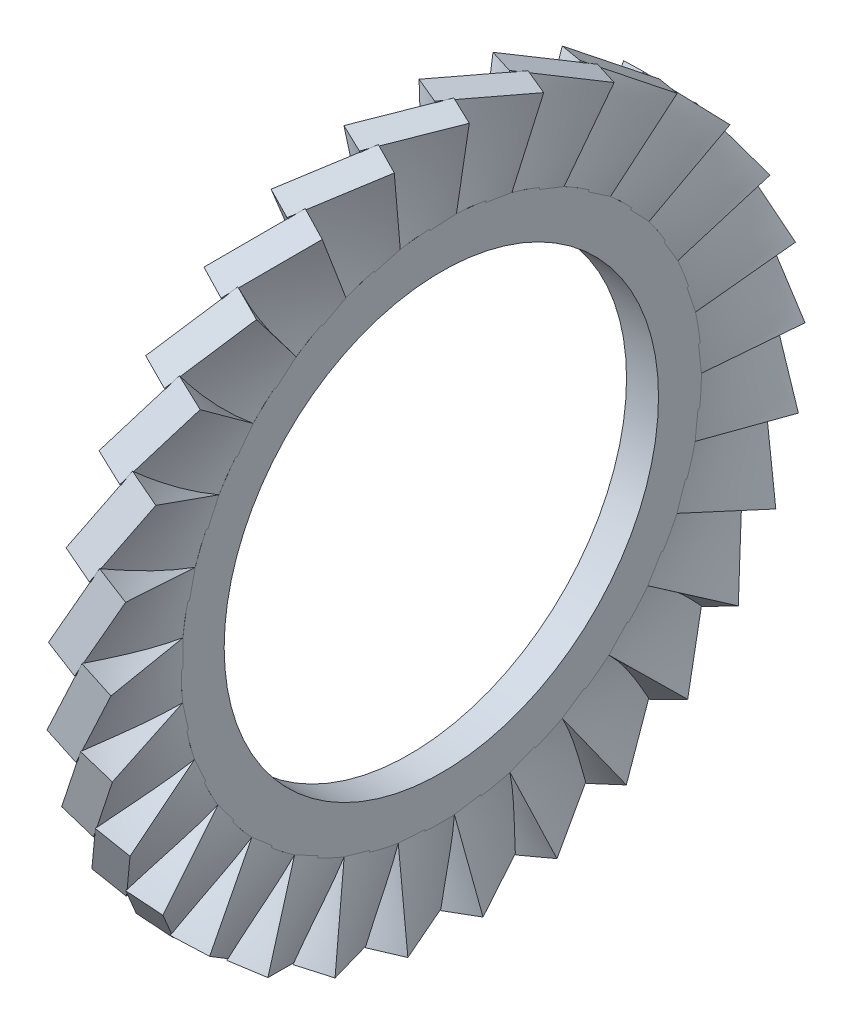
SolidWorks part; units mm, degrees
ref_plane "Plan1" through (0, 0, 0) normal (0, 0, 1) x (1, 0, 0)
ref_plane "Plan2" through (0, 0, 0) normal (0, 1, 0) x (1, 0, 0)
ref_plane "Plan3" through (0, 0, 0) normal (1, 0, 0) x (0, 0, -1)
sketch "Esquisse1" plane through (0, 0, 0) normal (0, 0, 1) x (1, 0, 0)
  line L0 (-4, 0) -> (4, 0) construction
  line L1 (0.6, 8.15) -> (-0.6, 8.15)
  line L2 (-0.6, 8.15) -> (-0.6, 9.76)
  line L3 (-0.6, 9.76) -> (0.6, 9.76)
  line L4 (0, 0) -> (0, 8) construction
  line L5 (0.6, 8.15) -> (0.6, 9.76)
  point P10 (0, 9.76)
  point P11 (0, 8.15)
  dimension "D1" = 8.15
  dimension "D2" = 9.76
  dimension "D3" = 0.6
revolve "Ame rondelle" add sketch "Esquisse1" angle 360 about L0
ref_plane "Plan4" through (0, 0, 9.6986) normal (0, 0, 1) x (1, 0, 0)
ref_plane "Plan5" through (0, 0, 13) normal (0, 0, 1) x (1, 0, 0)
sketch "Esquisse2" plane through (0, 0, 9.6986) normal (0, 0, 1) x (1, 0, 0)
  line L0 (0.6, 1.0928) -> (0.6, -1.0928)
  line L1 (-0.6, 1.0928) -> (0.6, 1.0928)
  line L3 (-0.6, 9.76) -> (-0.6, -9.76) construction
  line L4 (-0.6, 1.0928) -> (-0.6, -1.0928)
  line L5 (-1, 0) -> (1, 0) construction
  line L6 (-4, 0) -> (4, 0) construction
  line L7 (0, 0) -> (0, 1) construction
  line L11 (-0.6, -1.0928) -> (0.6, -1.0928)
  point P6 (0, -1.0928)
  point P14 (0, 1.0928)
  point P18 (0.6, 0)
  point P21 (-0.6, 0)
  dimension "D1" = 1.0928
sketch "Esquisse4" plane through (0, 0, 13) normal (0, 0, 1) x (1, 0, 0)
  line L0 (0, 0) -> (0.6, 1.2867) construction
  line L1 (0.6, -9.76) -> (0.6, 9.76) construction
  line L2 (0, 0) -> (0.6568, -0.3063) construction
  line L3 (0, 0) -> (0, 1) construction
  line L4 (0.1124, 1.6608) -> (1.2, 1.1537)
  line L5 (1.2, 1.1537) -> (-0.1124, -1.6608)
  line L7 (0.1124, 1.6608) -> (-1.2, -1.1537)
  line L8 (-1.2, -1.1537) -> (-0.1124, -1.6608)
  point P12 (0.6562, 1.4073)
  point P14 (-0.5438, 0.2536)
  point P15 (0.5438, -0.2536)
  dimension "D1" = 25
  dimension "D2" = 0.6
  dimension "D3" = 1.2
loft "1 dent" add profiles "Esquisse2", "Esquisse4"
pattern_circular "Répétition dents" count 29 over 360 about axis through (-4, 0, 0) along (1, 0, 0)
ref_plane "Plan d'appui 1" through (1.2, 0, 0) normal (1, 0, 0) x (0, 0, -1)
ref_plane "Plan d'appui 2" through (-1.2, 0, 0) normal (1, 0, 0) x (0, 0, -1)
equation "\"D2@Esquisse4\" = \"D3@Esquisse1\""
equation "\"D1@Plan d'appui 1\" = \"D3@Esquisse1\"*2"
equation "\"D1@Plan d'appui 2\" = \"D3@Esquisse1\"*2"
